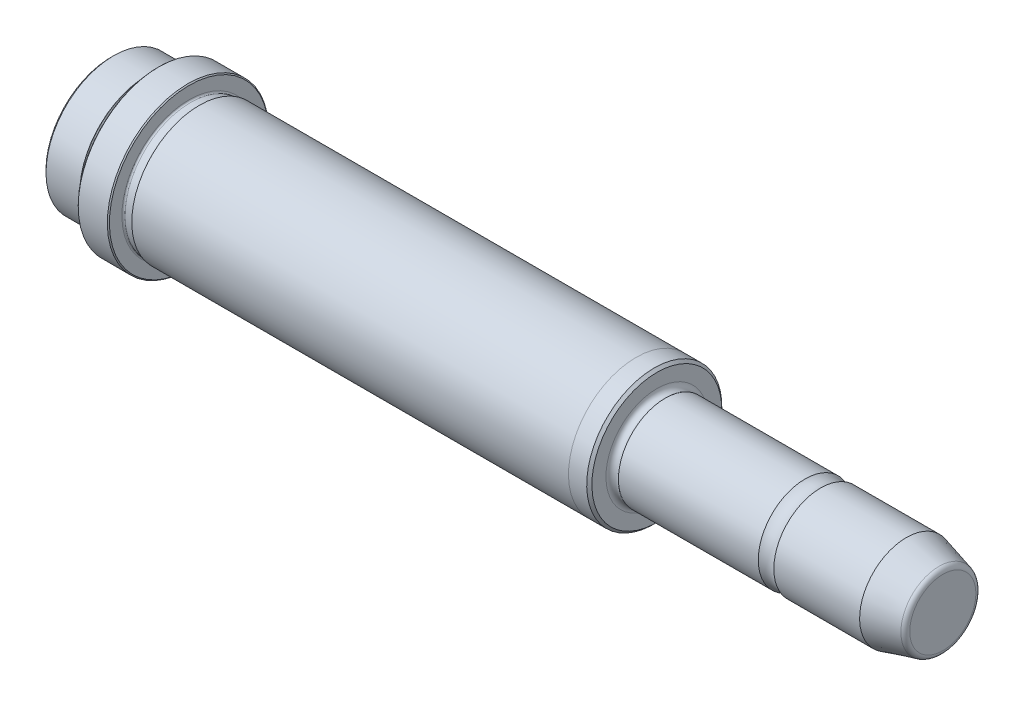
SolidWorks part; units mm, degrees
ref_plane "Front Plane" through (0, 0, 0) normal (0, 0, 1) x (1, 0, 0)
ref_plane "Top Plane" through (0, 0, 0) normal (0, 1, 0) x (1, 0, 0)
ref_plane "Right Plane" through (0, 0, 0) normal (1, 0, 0) x (0, 0, -1)
sketch "Sketch1" plane through (0, 0, 0) normal (0, 0, 1) x (1, 0, 0)
  line L0 (55, 7.1244) -> (48, 9)
  line L1 (48, 9) -> (1.6, 9)
  line L2 (0, 9.8) -> (0, 13)
  line L3 (0, 13) -> (-4, 13)
  line L4 (-88, 13.0001) -> (-88, 12.9)
  line L5 (-88.3, 12.6) -> (-89.7, 12.6)
  line L6 (-90, 12.9) -> (-90, 15.5)
  line L7 (-90, 15.5) -> (-96, 15.5)
  line L8 (-96, 15.5) -> (-96, 12.9)
  line L9 (-96.3, 12.6) -> (-97.7, 12.6)
  line L10 (-98, 12.9) -> (-98, 13)
  line L11 (-98, 13) -> (-105, 13)
  line L12 (-105, 13) -> (-105, 0)
  line L13 (55, 7.1244) -> (55, 0)
  line L14 (55, 0) -> (-55, 0) construction
  line L15 (55, 0) -> (-105, 0)
  line L16 (-4, 13.0001) -> (-88, 13.0001)
  line L17 (-4, 13.0001) -> (-4, 13)
  arc A0 (0, 9.8) -> (1.6, 9) centre (1, 9.8) ccw
  arc A1 (-96, 12.9) -> (-96.3, 12.6) centre (-96.3, 12.9) cw
  arc A2 (-97.7, 12.6) -> (-98, 12.9) centre (-97.7, 12.9) cw
  arc A3 (-89.7, 12.6) -> (-90, 12.9) centre (-89.7, 12.9) cw
  arc A4 (-88, 12.9) -> (-88.3, 12.6) centre (-88.3, 12.9) cw
  point P16 (0, 0)
  point P28 (-90, 12.6)
  point P31 (-88, 12.6)
  dimension "ShoulderRadii" = 2
  dimension "D5" = 0.3
  dimension "D1" = 15
  dimension "D2" = 0.4
  dimension "PinDia" = 18
  dimension "ChamferLeadIn" = 7
  dimension "ShoulderDia" = 26
  dimension "PinLengthN" = 55
  dimension "ShoulderLength" = 96
  dimension "D3" = 0.0001
  dimension "ShoulderGap" = 2
  dimension "D4" = 4
  dimension "T" = 6
  dimension "CollarLength" = 9
  dimension "HeadDia" = 31
  dimension "D8" = 0.2
revolve "Revolve1" add sketch "Sketch1" angle 360 about L14
sketch "Sketch2" plane through (0, 0, 0) normal (0, 0, 1) x (1, 0, 0)
  line L0 (55, -7.1244) -> (55, 7.1244) construction
  line L1 (145.9417, 8.6) -> (148.0583, 8.6) construction
  line L2 (48, 9) -> (1.6, 9) construction
  line L4 (28.5033, 9) -> (31.4967, 9)
  arc A0 (28.5033, 9) -> (31.4967, 9) centre (30, 11.6) ccw
  dimension "GrooveRadius" = 3
  dimension "D3" = 0.4
  dimension "AGroove" = 25
revolve "Groove A" cut sketch "Sketch2" angle 360 about axis through (55, 0, 0) along (1, 0, 0)
sketch "Sketch3" plane through (0, 0, 0) normal (0, 0, 1) x (1, 0, 0)
  line L0 (28.5033, 9) -> (1.6, 9) construction
  line L3 (28.3417, 9) -> (31.6583, 9)
  arc A0 (28.3417, 9) -> (31.6583, 9) centre (30, 11.5) ccw
  arc A1 (28.5033, 9) -> (31.4967, 9) centre (30, 11.6) ccw construction
  dimension "D1" = 0.5
  dimension "GroovePitch" = 0
revolve "Groove B" [suppressed] cut sketch "Sketch3" angle 360
sketch "Sketch4" [suppressed] plane through (0, 0, 0) normal (0, 0, 1) x (1, 0, 0)
  line L2 (60.3417, 9) -> (1.6, 9) construction
  line L3 (22.5033, 9) -> (25.4967, 9)
  arc A0 (22.5033, 9) -> (25.4967, 9) centre (24, 11.6) ccw
  arc A3 (60.3417, 9) -> (63.6583, 9) centre (62, 11.5) ccw construction
  dimension "D1" = 0.4
revolve "Groove C" [suppressed] cut sketch "Sketch4" angle 360
sketch "Sketch5" [suppressed] plane through (0, 0, 0) normal (0, 0, 1) x (1, 0, 0)
  line L0 (-15.4967, 9) -> (-12.5033, 9)
  line L1 (22.5033, 9) -> (1.6, 9) construction
  arc A0 (-15.4967, 9) -> (-12.5033, 9) centre (-14, 11.6) ccw
  arc A3 (22.5033, 9) -> (25.4967, 9) centre (24, 11.6) ccw construction
  dimension "D1" = 0.4
revolve "Groove D" [suppressed] cut sketch "Sketch5" angle 360
fillet "Fillet1" radius 1 1 edges at (55, 7.1244, 0)
chamfer "Chamfer1" distance 0.2 angle 45 2 edges at (-96, 15.5, 0) (-90, 15.5, 0)
chamfer "Chamfer2" distance 0.5 angle 45 2 edges at (-105, 13, 0) (0, 13, 0)
